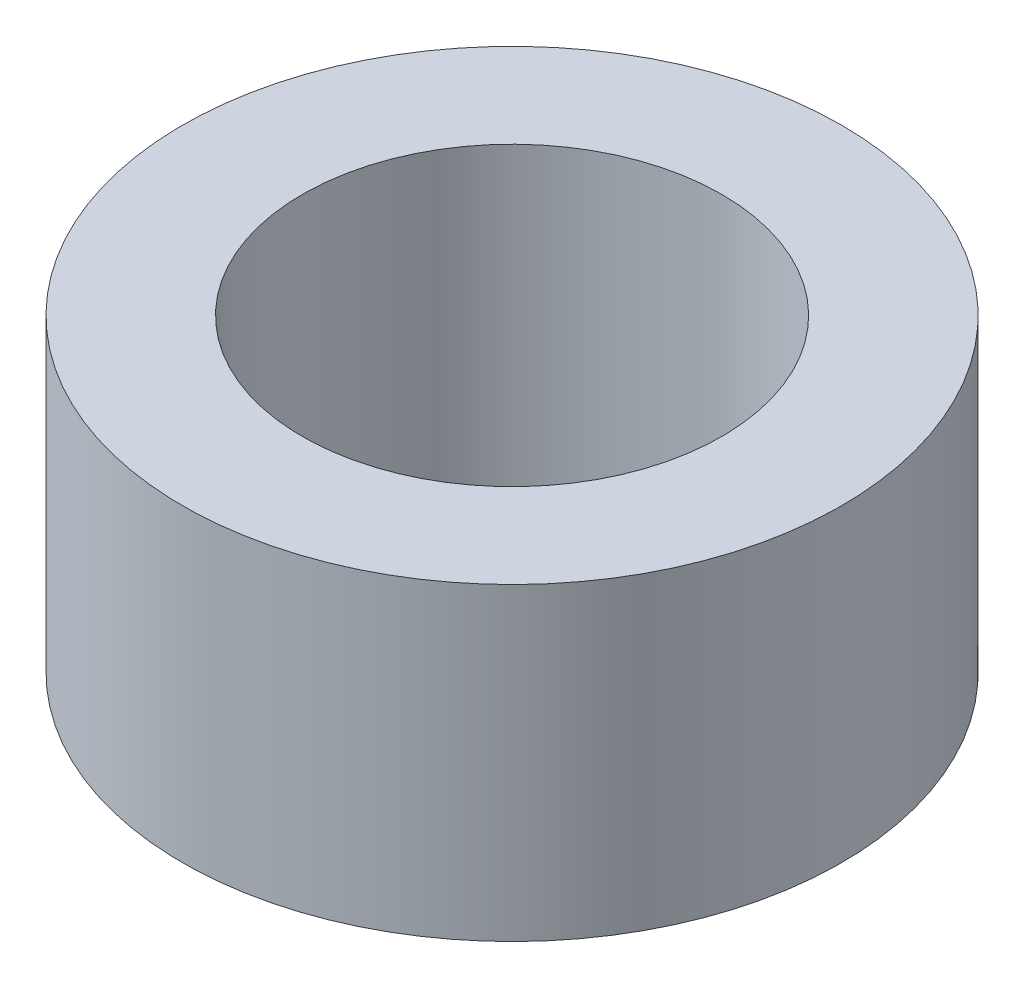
SolidWorks part; units mm, degrees
ref_plane "Front Plane" through (0, 0, 0) normal (0, 0, 1) x (1, 0, 0)
ref_plane "Top Plane" through (0, 0, 0) normal (0, 1, 0) x (1, 0, 0)
ref_plane "Right Plane" through (0, 0, 0) normal (1, 0, 0) x (0, 0, -1)
sketch "Sketch1" plane through (0, 0, 0) normal (0, 1, 0) x (1, 0, 0)
  circle A0 centre (0, 0) radius 13.75
  circle A1 centre (0, 0) radius 8.75
  dimension "D1" = 27.5
  dimension "D2" = 17.5
extrude "Extrude1" add sketch "Sketch1" along normal blind 12.9
